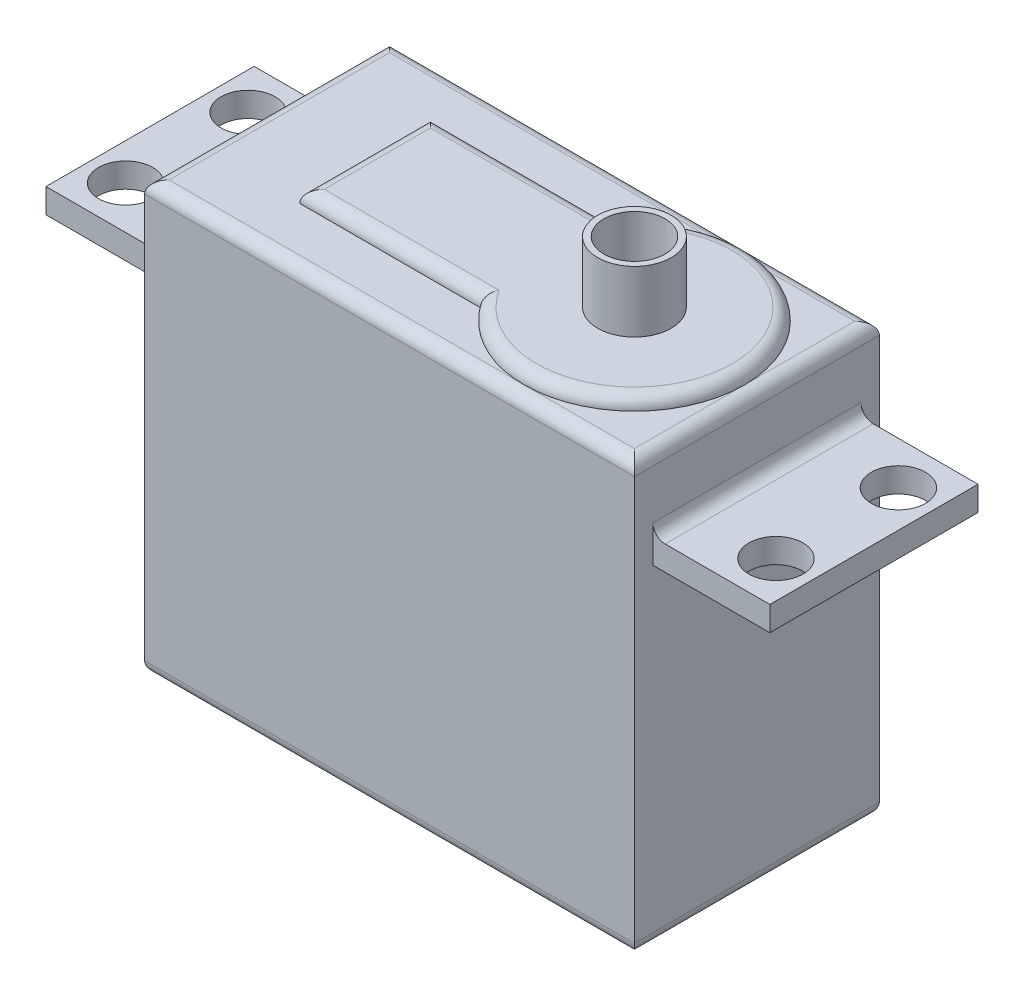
SolidWorks part; units mm, degrees
ref_plane "Front Plane" through (0, 0, 0) normal (0, 0, 1) x (1, 0, 0)
ref_plane "Top Plane" through (0, 0, 0) normal (0, 1, 0) x (1, 0, 0)
ref_plane "Right Plane" through (0, 0, 0) normal (1, 0, 0) x (0, 0, -1)
sketch "Sketch1" plane through (0, 0, 0) normal (0, 0, 1) x (1, 0, 0)
  line L1 (-20, 17.5) -> (20, 17.5)
  line L2 (-20, 17.5) -> (-20, -17.5)
  line L3 (-20, -17.5) -> (20, -17.5)
  line L4 (20, 17.5) -> (20, -17.5)
  line L5 (-20, 17.5) -> (20, -17.5) construction
  line L6 (-20, -17.5) -> (20, 17.5) construction
  point P0 (0, 0)
  dimension "D1" = 40
  dimension "D2" = 35
extrude "Boss-Extrude1" add sketch "Sketch1" along normal blind 20
fillet "Fillet1" radius 1 8 edges at (0, -17.5, 0) (-20, -17.5, 10) (20, -17.5, 10) (0, -17.5, 20) (0, 17.5, 0) (20, 17.5, 10) (0, 17.5, 20) (-20, 17.5, 10)
ref_plane "Plane1" through (0, 9.5, 0) normal (0, 1, 0) x (-1, 0, 0)
sketch "Sketch2" plane through (0, 9.5, 0) normal (0, 1, 0) x (-1, 0, 0)
  line L0 (20, 10) -> (-20, 10) construction
  line L1 (20, 20) -> (20, 0) construction
  line L2 (-20, 0) -> (-20, 20) construction
  line L3 (-20, 10) -> (-33.3686, 10) construction
  line L4 (0, 20) -> (0, 0) construction
  line L5 (-20, 20) -> (20, 20) construction
  line L6 (29.5562, 1.5) -> (20, 1.5)
  line L7 (-29.5562, 18.5) -> (-20, 18.5)
  line L8 (-29.5562, 18.5) -> (-29.5562, 1.5)
  line L9 (-29.5562, 1.5) -> (-20, 1.5)
  line L10 (-20, 18.5) -> (-20, 1.5)
  line L11 (-29.5562, 18.5) -> (-20, 1.5) construction
  line L12 (-29.5562, 1.5) -> (-20, 18.5) construction
  line L13 (20, 18.5) -> (20, 1.5)
  line L14 (29.5562, 18.5) -> (20, 18.5)
  line L15 (29.5562, 18.5) -> (29.5562, 1.5)
  circle A0 centre (-26.5562, 5) radius 2.2095
  circle A1 centre (-26.5562, 15) radius 2.2095
  circle A2 centre (26.5562, 5) radius 2.2095
  circle A3 centre (26.5562, 15) radius 2.2095
  point P12 (-24.7781, 10)
  dimension "D1" = 17
  dimension "D2" = 3
  dimension "D3" = 5
extrude "Boss-Extrude2" add sketch "Sketch2" along normal blind 2
sketch "Sketch3" plane through (0, 17.5, 0) normal (0, 1, 0) x (1, 0, 0)
  line L0 (10, -10) -> (-19, -10) construction
  line L1 (-19, -1) -> (-19, -19) construction
  line L2 (-12, -15.3326) -> (-12, -4.6674)
  line L3 (-12, -4.6674) -> (2.7499, -4.6674)
  line L4 (-12, -15.3326) -> (2.7499, -15.3326)
  circle A0 centre (10, -10) radius 9
  point P9 (-12, -10)
  dimension "D1" = 10.6652
  dimension "D2" = 22
extrude "Boss-Extrude3" add sketch "Sketch3" along normal blind 1
sketch "Sketch4" plane through (0, 18.5, 0) normal (0, 1, 0) x (1, 0, 0)
  circle A0 centre (10, -10) radius 2.5
  circle A1 centre (10, -10) radius 3
  dimension "D1" = 6
  dimension "D2" = 5
extrude "Boss-Extrude4" add sketch "Sketch4" along normal blind 5
fillet "Fillet2" radius 1 10 edges at (20, 11.5, 10) (-20, 11.5, 10) (-12, 18.5, 10) (-12, 18, 4.6674) (-12, 18, 15.3326) (2.7499, 18, 15.3326) (-4.625, 18.5, 4.6674) (2.7499, 18, 4.6674) (-4.625, 18.5, 15.3326) (19, 18.5, 10)
